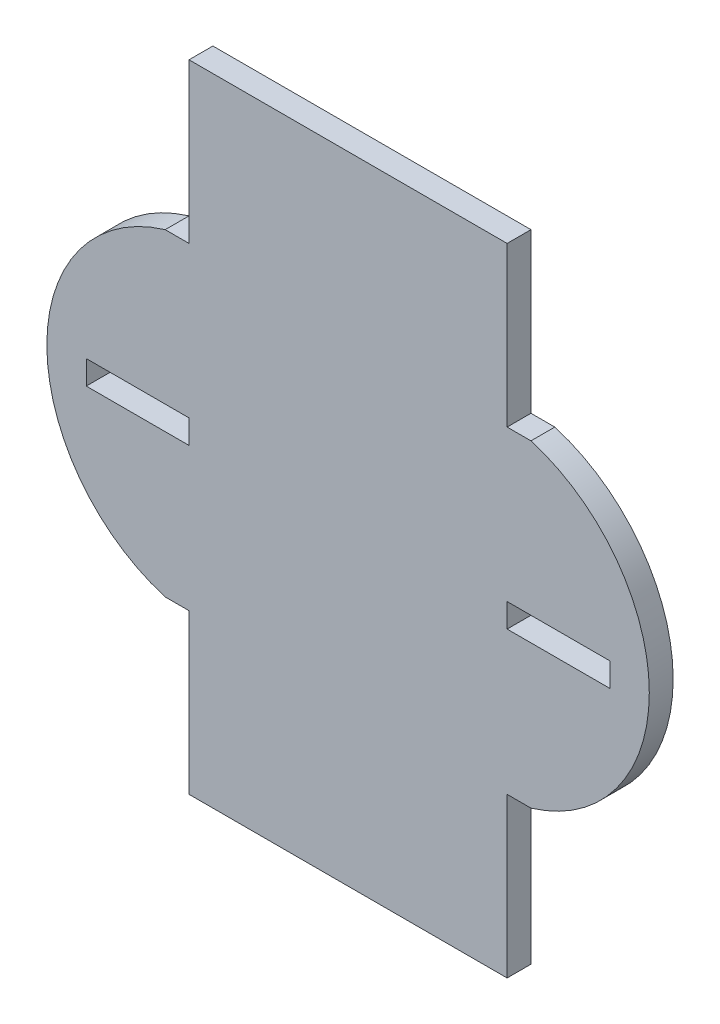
SolidWorks part; units mm, degrees
ref_plane "Plan de face" through (0, 0, 0) normal (0, 0, 1) x (1, 0, 0)
ref_plane "Plan de dessus" through (0, 0, 0) normal (0, 1, 0) x (1, 0, 0)
ref_plane "Plan de droite" through (0, 0, 0) normal (1, 0, 0) x (0, 0, -1)
sketch "Esquisse1" plane through (0, 0, 0) normal (0, 0, 1) x (1, 0, 0)
  line L0 (-21.3158, 46.8156) -> (-24.3158, 46.8156)
  line L1 (-21.3158, 66.8156) -> (18.6842, 66.8156)
  line L2 (-21.3158, 66.8156) -> (-21.3158, 46.8156)
  line L3 (-21.3158, -13.1844) -> (18.6842, -13.1844)
  line L4 (18.6842, 66.8156) -> (18.6842, 46.8156)
  line L6 (-24.3158, 6.8156) -> (-21.3158, 6.8156)
  line L7 (-1.3158, -13.1844) -> (-1.3158, 66.8156) construction
  line L8 (21.6842, 6.8156) -> (18.6842, 6.8156)
  line L10 (18.6842, 46.8156) -> (21.6842, 46.8156)
  line L11 (-21.3158, 6.8156) -> (-21.3158, -13.1844)
  line L12 (18.6842, 6.8156) -> (18.6842, -13.1844)
  line L13 (-34.2397, 24.8156) -> (-34.2397, 27.8156)
  line L14 (-21.3158, 24.8156) -> (-34.2397, 24.8156)
  line L15 (-21.3158, 24.8156) -> (-21.3158, 27.8156)
  line L16 (18.6842, 24.8156) -> (31.6081, 24.8156)
  line L17 (18.6842, 24.8156) -> (18.6842, 27.8156)
  line L18 (18.6842, 27.8156) -> (31.6081, 27.8156)
  line L19 (31.6081, 24.8156) -> (31.6081, 27.8156)
  line L20 (-21.3158, 27.8156) -> (-34.2397, 27.8156)
  arc A0 (21.6842, 46.8156) -> (21.6842, 6.8156) centre (15.6842, 26.8156) cw
  arc A1 (-24.3158, 46.8156) -> (-24.3158, 6.8156) centre (-18.3158, 26.8156) ccw
  dimension "D1" = 40
  dimension "D2" = 80
  dimension "D3" = 3
  dimension "D4" = 20
  dimension "D5" = 40
  dimension "D6" = 3
  dimension "D7" = 12.9239
  dimension "D8" = 18
extrude "Boss.-Extru.1" add sketch "Esquisse1" along normal blind 3
